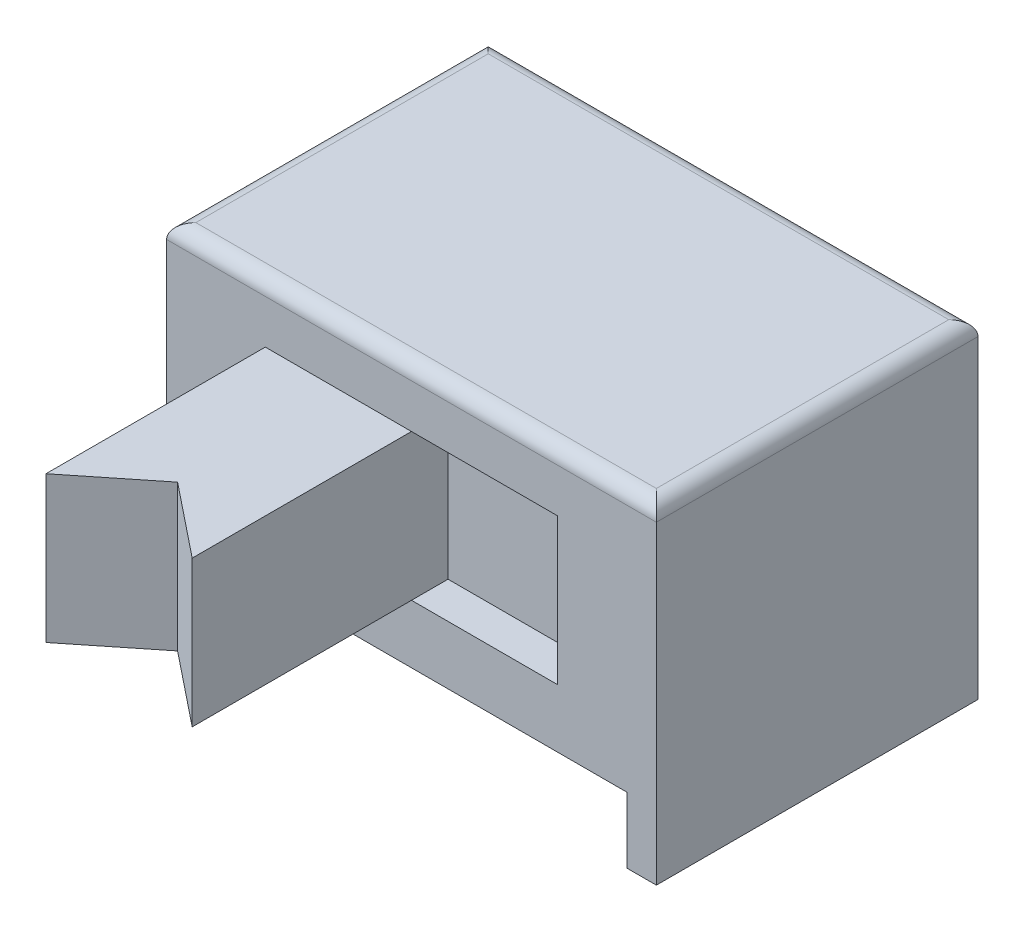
SolidWorks part; units mm, degrees
ref_plane "Plan de face" through (0, 0, 0) normal (0, 0, 1) x (1, 0, 0)
ref_plane "Plan de dessus" through (0, 0, 0) normal (0, 1, 0) x (1, 0, 0)
ref_plane "Plan de droite" through (0, 0, 0) normal (1, 0, 0) x (0, 0, -1)
sketch "Esquisse1" plane through (0, 0, 0) normal (0, 1, 0) x (1, 0, 0)
  line L1 (0, 0) -> (6.7, 0)
  line L2 (0, 0) -> (0, 4.4)
  line L3 (0, 4.4) -> (6.7, 4.4)
  line L4 (6.7, 0) -> (6.7, 4.4)
  dimension "D1" = 6.7
  dimension "D2" = 4.4
extrude "Extrusion1" add sketch "Esquisse1" along normal blind 4.5
sketch "Esquisse2" plane through (0, 0, 0) normal (0, 0, 1) x (1, 0, 0)
  line L0 (0, 4.5) -> (6.7, 4.5) construction
  line L1 (1.35, 3.7) -> (5.35, 3.7)
  line L2 (1.35, 3.7) -> (1.35, 1.7)
  line L3 (1.35, 1.7) -> (5.35, 1.7)
  line L4 (5.35, 3.7) -> (5.35, 1.7)
  line L5 (3.35, 4.5) -> (3.35, 2.8529) construction
  line L6 (3.35, 3.7) -> (3.35, 2.7332) construction
  dimension "D1" = 4
  dimension "D2" = 2
  dimension "D3" = 0.8
extrude "Enlèv. mat.-Extru.1" cut sketch "Esquisse2" against normal blind 0.5
sketch "Esquisse3" plane through (0, 0, -0.5) normal (0, 0, 1) x (1, 0, 0)
  line L0 (1.35, 3.7) -> (1.35, 1.7) construction
  line L1 (1.35, 3.7) -> (3.35, 3.7)
  line L2 (1.35, 3.7) -> (1.35, 1.7)
  line L3 (1.35, 1.7) -> (3.35, 1.7)
  line L4 (3.35, 3.7) -> (3.35, 1.7)
  line L5 (5.35, 3.7) -> (1.35, 3.7) construction
  line L6 (1.35, 1.7) -> (5.35, 1.7) construction
  dimension "D1" = 2
extrude "Extrusion2" add sketch "Esquisse3" along normal blind 3.5
sketch "Esquisse4" plane through (0, 1.7, 0) normal (0, -1, 0) x (1, 0, 0)
  line L0 (2.35, 3) -> (2.35, 2.2) construction
  line L1 (1.35, 3) -> (3.35, 3) construction
  line L2 (2.35, 2.2) -> (3.35, 3)
  line L3 (3.35, 3) -> (1.35, 3)
  line L4 (1.35, 3) -> (2.35, 2.2)
  dimension "D1" = 0.8
extrude "Enlèv. mat.-Extru.2" cut sketch "Esquisse4" against normal through all
fillet "Congé2" radius 0.2 4 edges at (6.7, 4.5, -2.2) (3.35, 4.5, -4.4) (0, 4.5, -2.2) (3.35, 4.5, 0)
sketch "Esquisse5" plane through (0, 0, 0) normal (0, 0, 1) x (1, 0, 0)
  line L0 (0, 0) -> (6.7, 0) construction
  line L1 (0.4, 0) -> (6.3, 0)
  line L2 (0.4, 0) -> (0.4, 0.9)
  line L3 (0.4, 0.9) -> (6.3, 0.9)
  line L4 (6.3, 0) -> (6.3, 0.9)
  line L5 (6.7, 4.3) -> (6.7, 0) construction
  line L6 (0, 4.3) -> (0, 0) construction
  line L8 (3.35, 1.7) -> (5.35, 1.7) construction
  dimension "D1" = 0.4
  dimension "D2" = 0.4
  dimension "D3" = 0.8
extrude "Enlèv. mat.-Extru.3" cut sketch "Esquisse5" against normal through all
